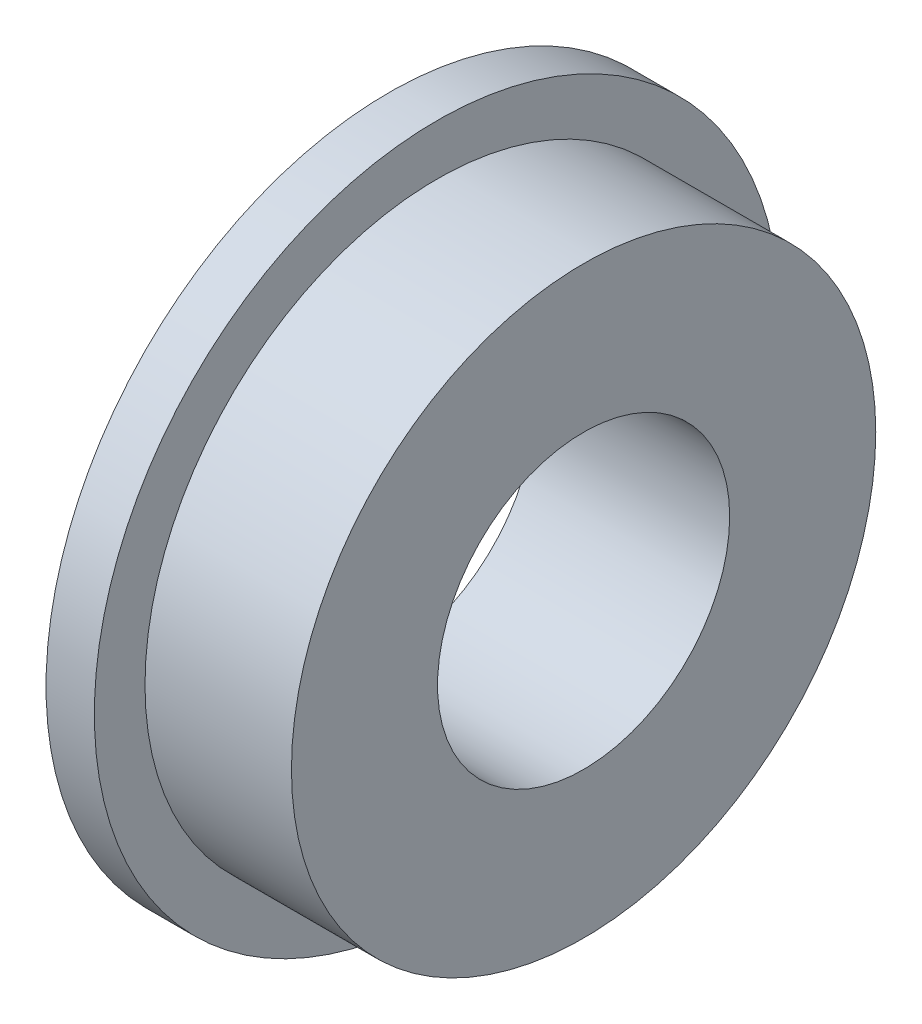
SolidWorks part; units mm, degrees
ref_plane "Front" through (0, 0, 0) normal (0, 0, 1) x (1, 0, 0)
ref_plane "Top" through (0, 0, 0) normal (0, 1, 0) x (1, 0, 0)
ref_plane "Right" through (0, 0, 0) normal (1, 0, 0) x (0, 0, -1)
sketch "Sketch1" plane through (0, 0, 0) normal (0, 0, 1) x (1, 0, 0)
  line L0 (0, 0) -> (-18.8006, 0) construction
  line L1 (0, 2.3812) -> (0, 4.7625)
  line L2 (0, 4.7625) -> (-2.3876, 4.7625)
  line L3 (-2.3876, 4.7625) -> (-2.3876, 5.588)
  line L4 (-2.3876, 5.588) -> (-3.175, 5.588)
  line L5 (-3.175, 5.588) -> (-3.175, 2.3812)
  line L6 (-3.175, 2.3812) -> (0, 2.3812)
  dimension "D1" = 4.7625
  dimension "D2" = 9.525
  dimension "D3" = 11.176
  dimension "D4" = 3.175
  dimension "D5" = 0.7874
revolve "Revolve1" add sketch "Sketch1" angle 360 about L0
